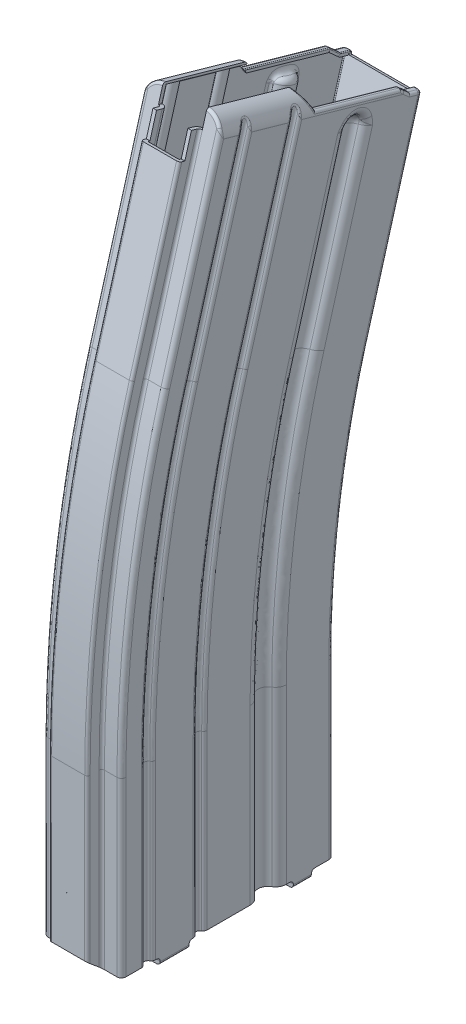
SolidWorks part; units mm, degrees
ref_plane "Front Plane" through (0, 0, 0) normal (0, 0, 1) x (1, 0, 0)
ref_plane "Top Plane" through (0, 0, 0) normal (0, 1, 0) x (1, 0, 0)
ref_plane "Right Plane" through (0, 0, 0) normal (1, 0, 0) x (0, 0, -1)
imported_body "MAGAZINE"
sketch "Sketch1" plane through (11.049, 0, 0) normal (1, 0, 0) x (0, 0, -1)
  line L0 (5.6904, 55.1756) -> (-2.564, 55.1756)
  line L1 (-2.564, 55.1756) -> (-2.564, 8.5321)
  line L2 (-2.564, 8.5321) -> (5.6904, 8.5321)
  line L3 (5.6904, 8.5321) -> (5.6904, 55.1756)
extrude "Boss-Extrude1" add sketch "Sketch1" against normal blind 0.8255
sketch "Sketch2" plane through (-11.049, 0, 0) normal (-1, 0, 0) x (0, 0, 1)
  line L0 (2.3576, 7.4741) -> (2.3576, 55.4179)
  line L1 (2.3576, 55.4179) -> (-4.4217, 55.4179)
  line L2 (-4.4217, 55.4179) -> (-4.4217, 7.4741)
  line L3 (-4.4217, 7.4741) -> (2.3576, 7.4741)
extrude "Boss-Extrude2" add sketch "Sketch2" against normal blind 0.8255
ref_plane "Plane1" through (-8.89, 0, 0) normal (1, 0, 0) x (0, 0, -1)
ref_plane "Plane2" through (8.89, 0, 0) normal (-1, 0, 0) x (0, 0, 1)
